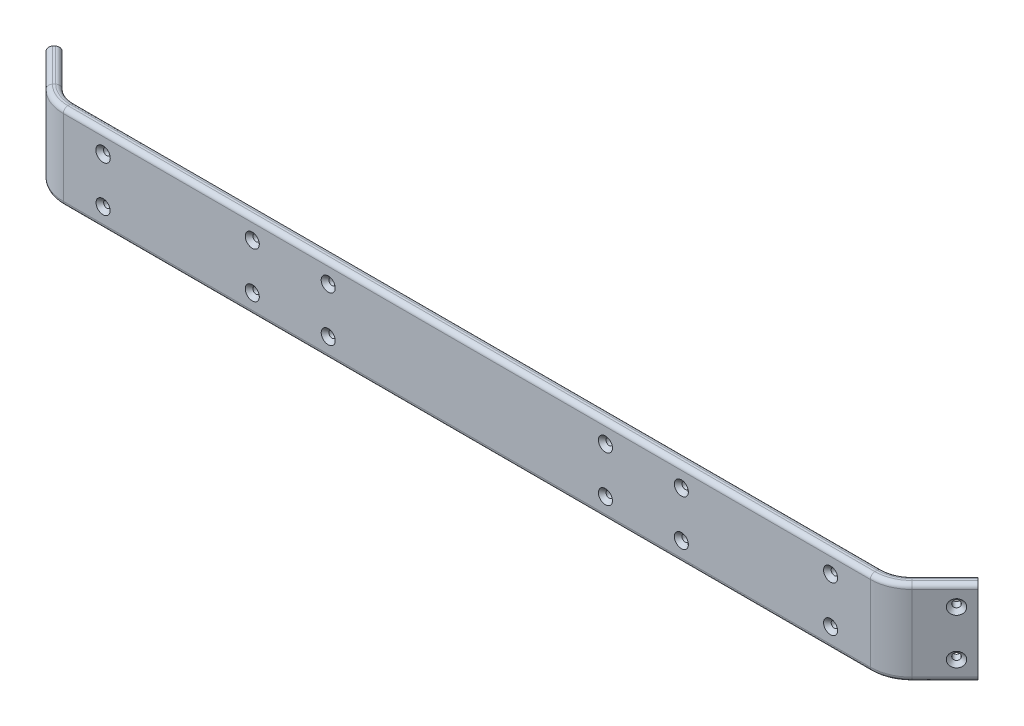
SolidWorks part; units mm, degrees
ref_plane "Plan1" through (0, 0, 0) normal (0, 0, 1) x (1, 0, 0)
ref_plane "Plan2" through (0, 0, 0) normal (0, 1, 0) x (1, 0, 0)
ref_plane "Plan3" through (0, 0, 0) normal (1, 0, 0) x (0, 0, -1)
sketch "Esquisse1" plane through (0, 0, 0) normal (0, 0, 1) x (1, 0, 0)
  line L0 (339, 112) -> (1599, 112)
  line L1 (339, 112) -> (339, 0)
  line L2 (1599, 0) -> (339, 0)
  line L3 (1599, 0) -> (1599, 112)
  circle A3 centre (490, 86) radius 4.5
  circle A4 centre (359, 86) radius 4.5
  circle A5 centre (359, 26) radius 4.5
  circle A6 centre (1579, 86) radius 4.5
  circle A7 centre (1579, 26) radius 4.5
  circle A8 centre (1151.5, 86) radius 4.25
  circle A9 centre (1151.5, 26) radius 4.25
  circle A10 centre (1251.5, 86) radius 4.25
  circle A11 centre (1251.5, 26) radius 4.25
  circle A17 centre (786.5, 86) radius 4.25
  circle A18 centre (786.5, 26) radius 4.25
  circle A19 centre (490, 26) radius 4.25
  circle A20 centre (686.5, 86) radius 4.25
  circle A21 centre (686.5, 26) radius 4.25
  circle A22 centre (1448, 86) radius 4.25
  circle A23 centre (1448, 26) radius 4.25
  point P10 (339, 0)
  point P13 (1599, 112)
  point P16 (1599, 0)
  dimension "D3" = 131
  dimension "D4" = 365
  dimension "D7" = 9
  dimension "D1" = 112
  dimension "D2" = 1260
  dimension "D5" = 26
  dimension "D6" = 20
  dimension "D8" = 60
  dimension "D9" = 26
  dimension "D10" = 20
  dimension "D11" = 131
  dimension "D15" = 196.5
  dimension "D17" = 100
  dimension "D18" = 100
  dimension "D19" = 196.5
extrude "Base-Extrusion" add sketch "Esquisse1" along normal blind 15
sheet metal parameters "Tôlerie 1" parameters "D1"=40
flatten bends "Dépliage 1" parameters "D1"=0
sketch "Esquisse-Angle1" plane through (0, 0, 0) normal (0, 0, -1) x (-1, 0, 0)
process bends "Pliage 1" parameters "D1"=0
sketch "Esquisse-Plate1" plane through (0, 0, 0) normal (0, 0, -1) x (-1, 0, 0)
  line L0 (-1519, 112) -> (-1519, 0)
  line L1 (-339, 112) -> (-1599, 112) construction
  line L2 (-419, 112) -> (-419, 0)
  line L3 (-1599, 0) -> (-339, 0) construction
  line L4 (-1599, 0) -> (-1599, 112) construction
  line L5 (-339, 112) -> (-339, 0) construction
  point P4 (-1496.6, 56)
  dimension "D1" = 80
  dimension "D2" = 80
bend "Pli défini à plat1" bend radius 30 bend angle 45 parameters "D5"=1
bend "Pli défini à plat2" bend radius 30 bend angle 45 parameters "D5"=2
fillet "Congé1" radius 6
chamfer "Chanfrein1" distance 5 angle 45
